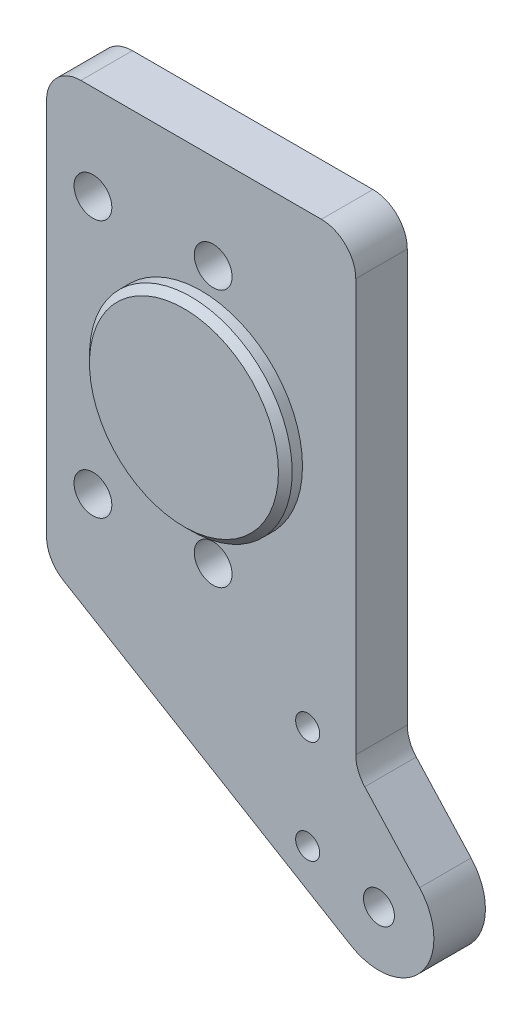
SolidWorks part; units mm, degrees
ref_plane "Plan de face" through (0, 0, 0) normal (0, 0, 1) x (1, 0, 0)
ref_plane "Plan de dessus" through (0, 0, 0) normal (0, 1, 0) x (1, 0, 0)
ref_plane "Plan de droite" through (0, 0, 0) normal (1, 0, 0) x (0, 0, -1)
sketch "Esquisse1" plane through (0, 0, 0) normal (0, 0, 1) x (1, 0, 0)
  circle A0 centre (0, 0) radius 29.5
  dimension "D1" = 59
extrude "Boss.-Extru.1" add sketch "Esquisse1" along normal blind 5
sketch "Esquisse2" plane through (0, 0, 5) normal (0, 0, 1) x (1, 0, 0)
  line L0 (47.6153, -71.7428) -> (63.5655, -89.2114)
  line L1 (-35, 65) -> (35, 65)
  line L2 (-45, 55) -> (-45, -55)
  line L4 (45, 55) -> (45, -65)
  line L5 (-40.141, -63.5773) -> (43.5244, -113.7237)
  arc A0 (45, 55) -> (35, 65) centre (35, 55) ccw
  arc A1 (-45, 55) -> (-35, 65) centre (-35, 55) cw
  arc A2 (43.5244, -113.7237) -> (63.5655, -89.2114) centre (51.75, -100) ccw
  arc A3 (47.6153, -71.7428) -> (45, -65) centre (55, -65) cw
  arc A5 (-40.141, -63.5773) -> (-45, -55) centre (-35, -55) cw
  point P7 (45, 65)
  point P10 (-45, 65)
  point P20 (0, 65)
  dimension "D3" = 10
  dimension "D4" = 10
  dimension "D5" = 32
  dimension "D8" = 10
  dimension "D9" = 120
  dimension "D10" = 10
  dimension "D1" = 90
  dimension "D2" = 65
  dimension "D6" = 96.75
  dimension "D7" = 100
  dimension "D11" = 120
extrude "Boss.-Extru.2" add sketch "Esquisse2" along normal blind 15
chamfer "Chanfrein1" distance 2 angle 45 1 edges at (29.5, 0, 0)
sketch "Esquisse3" plane through (0, 0, 20) normal (0, 0, 1) x (1, 0, 0)
  line L0 (-45, 55) -> (-45, -55) construction
  line L1 (35, 65) -> (-35, 65) construction
  circle A0 centre (-31.5, -37.5) radius 5.5
  dimension "D1" = 11
  dimension "D2" = 13.5
  dimension "D3" = 102.5
extrude "Enlèv. mat.-Extru.1" cut sketch "Esquisse3" against normal up to surface (15 mm away)
pattern_linear "Répétition linéaire1" count 2 spacing 35 along (1, 0, 0) count 2 spacing 75 along (0, 1, 0) of "Enlèv. mat.-Extru.1"
sketch "Esquisse4" plane through (0, 0, 20) normal (0, 0, 1) x (1, 0, 0)
  circle A0 centre (51.75, -100) radius 4.5
  arc A1 (43.5244, -113.7237) -> (63.5655, -89.2114) centre (51.75, -100) ccw construction
  dimension "D1" = 9
extrude "Enlèv. mat.-Extru.2" cut sketch "Esquisse4" against normal up to surface (15 mm away)
sketch "Esquisse5" plane through (0, 0, 20) normal (0, 0, 1) x (1, 0, 0)
  line L1 (45, -65) -> (45, 55) construction
  circle A0 centre (31, -65) radius 3.5
  dimension "D3" = 7
  dimension "D1" = 65
  dimension "D2" = 14
extrude "Enlèv. mat.-Extru.3" cut sketch "Esquisse5" against normal up to surface (15 mm away)
pattern_linear "Répétition linéaire2" count 2 spacing 30 along (0, -1, 0) of "Enlèv. mat.-Extru.3"
sketch "Esquisse6" plane through (0, 0, 20) normal (0, 0, 1) x (1, 0, 0)
  circle A0 centre (0, 0) radius 29.5
  circle A1 centre (0, 0) radius 29.5 construction
extrude "Boss.-Extru.3" add sketch "Esquisse6" along normal blind 5
chamfer "Chanfrein2" distance 2 angle 45 1 edges at (29.5, 0, 25)
sketch "Esquisse7" plane through (0, 0, 0) normal (0, 0, -1) x (-1, 0, 0)
  circle A0 centre (0, 0) radius 29.5
  circle A1 centre (0, 0) radius 29.5 construction
extrude "Enlèv. mat.-Extru.4" cut sketch "Esquisse7" against normal up to surface (5 mm away)
